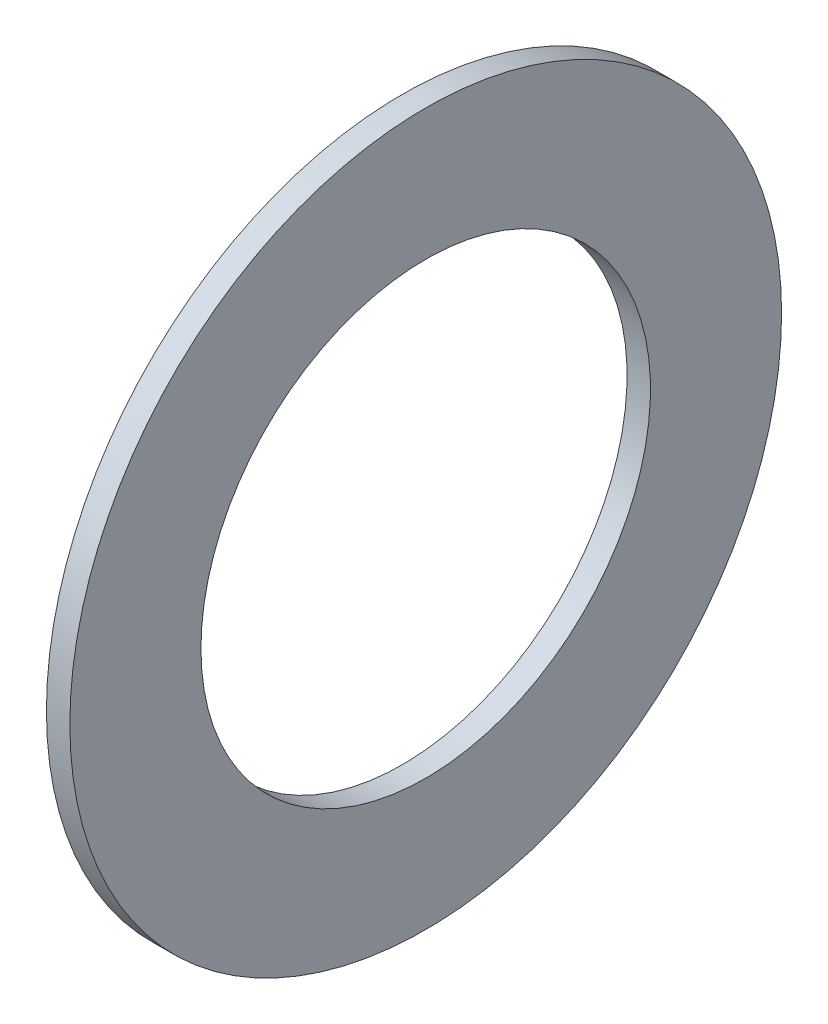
SolidWorks part; units mm, degrees
ref_plane "Face" through (0, 0, 0) normal (0, 0, 1) x (1, 0, 0)
ref_plane "Dessus" through (0, 0, 0) normal (0, 1, 0) x (1, 0, 0)
ref_plane "Droite" through (0, 0, 0) normal (1, 0, 0) x (0, 0, -1)
sketch "Esquisse1" plane through (0, 0, 0) normal (0, 0, 1) x (1, 0, 0)
  line L0 (-11.8056, 0) -> (15.3473, 0) construction
  line L2 (-1, 15.2) -> (0, 15.2)
  line L3 (-1, 15.2) -> (-1, 9.6)
  line L4 (-1, 9.6) -> (0, 9.6)
  line L5 (0, 15.2) -> (0, 9.6)
  dimension "D1" = 19.2
  dimension "D2" = 30.4
  dimension "D3" = 1
revolve "Base-Révolution" add sketch "Esquisse1" angle 360 about L0
